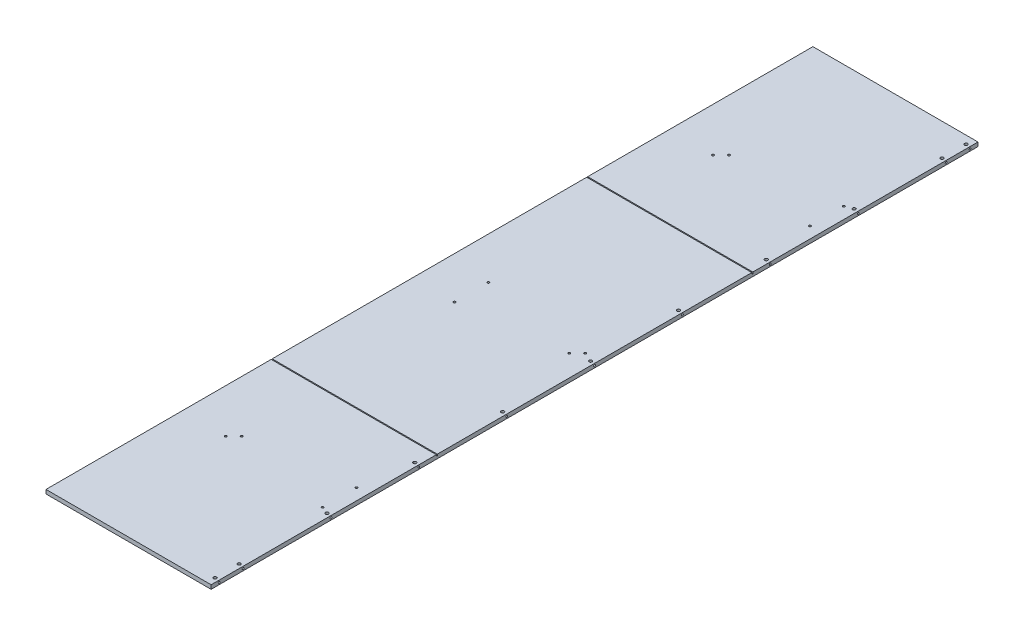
SolidWorks part; units mm, degrees
ref_plane "Front" through (0, 0, 0) normal (0, 0, 1) x (1, 0, 0)
ref_plane "Top" through (0, 0, 0) normal (0, 1, 0) x (1, 0, 0)
ref_plane "Right" through (0, 0, 0) normal (1, 0, 0) x (0, 0, -1)
sketch "Sketch1" plane through (0, 0, 0) normal (0, 1, 0) x (1, 0, 0)
  line L2 (0, 0) -> (0, 1025.398)
  line L4 (524.999, 0) -> (524.999, 1025.398)
  line L6 (0, 1025.398) -> (0, 1731.899)
  line L7 (0, 1731.899) -> (524.999, 1731.899)
  line L8 (524.999, 1025.398) -> (524.999, 1731.899)
  line L10 (0, 0) -> (0, -706.501)
  line L11 (0, -706.501) -> (524.999, -706.501)
  line L12 (524.999, 0) -> (524.999, -706.501)
  dimension "D1" = 1025.398
  dimension "D2" = 524.999
  dimension "D3" = 706.501
  dimension "D4" = 706.501
extrude "Extrude1" add sketch "Sketch1" along normal blind 12.7
sketch "Sketch2" plane through (0, 12.7, 0) normal (0, 1, 0) x (1, 0, 0)
  line L1 (-64.3156, 12.7) -> (592.8604, 12.7)
  line L2 (-64.3156, 12.7) -> (-64.3156, 9.525)
  line L3 (-64.3156, 9.525) -> (592.8604, 9.525)
  line L4 (592.8604, 12.7) -> (592.8604, 9.525)
  line L5 (524.999, 512.699) -> (636.1805, 512.699) construction
  line L6 (524.999, -706.501) -> (524.999, 1731.899) construction
  line L7 (592.8604, 1012.698) -> (592.8604, 1015.873)
  line L8 (-64.3156, 1015.873) -> (592.8604, 1015.873)
  line L9 (-64.3156, 1012.698) -> (-64.3156, 1015.873)
  line L10 (-64.3156, 1012.698) -> (592.8604, 1012.698)
  line L11 (0, -706.501) -> (524.999, -706.501) construction
  dimension "D2" = 3.175
  dimension "D3" = 719.201
extrude "Cut-Extrude1" cut sketch "Sketch2" against normal blind 4.7625
sketch "Sketch3" plane through (0, 0, 0) normal (0, -1, 0) x (1, 0, 0)
  circle A0 centre (488.95, -1233.3706) radius 3.3731
  circle A1 centre (488.95, -1341.3206) radius 3.3731
  circle A2 centre (482.6, -525.399) radius 3.3731
  circle A3 centre (488.95, 316.0294) radius 3.3731
  circle A4 centre (488.95, 208.0794) radius 3.3731
  circle A5 centre (165.1, 249.301) radius 3.3731
  circle A6 centre (165.1, -1300.099) radius 3.3731
  circle A7 centre (139.7, -1274.699) radius 3.3731
  circle A8 centre (457.2, -499.999) radius 3.3731
  circle A9 centre (139.7, 274.701) radius 3.3731
  dimension "D1" = 6.7462
  dimension "D2" = 6.7462
  dimension "D3" = 6.7462
  dimension "D4" = 6.7462
  dimension "D5" = 6.7462
extrude "Cut-Extrude2" cut sketch "Sketch3" against normal through all
sketch "Sketch4" plane through (0, 0, 0) normal (0, -1, 0) x (1, 0, 0)
  circle A0 centre (133.35, -566.6206) radius 3.3731
  circle A1 centre (133.35, -458.7774) radius 3.3731
  dimension "D1" = 6.7462
extrude "Cut-Extrude3" cut sketch "Sketch4" against normal through all
sketch "Sketch5" plane through (0, 12.7, 0) normal (0, 1, 0) x (1, 0, 0)
  line L0 (524.9989, 1015.873) -> (524.999, 1731.899) construction
  line L2 (512.2989, 1630.299) -> (512.2989, -778.6842) construction
  line L4 (0, -706.501) -> (524.999, -706.501) construction
  line L5 (0, 512.699) -> (512.2989, 512.699) construction
  line L6 (0, 1012.698) -> (0, 12.7) construction
  line L7 (524.999, 1731.899) -> (0, 1731.899) construction
  line L8 (524.999, -706.501) -> (524.999, 9.525) construction
  circle A0 centre (512.2989, 1630.299) radius 4.9022
  circle A1 centre (512.2989, 1350.899) radius 4.9022
  circle A2 centre (512.2989, 1071.499) radius 4.9022
  circle A3 centre (512.2989, 792.099) radius 4.9022
  circle A4 centre (512.2989, 512.699) radius 4.9022
  circle A5 centre (512.2989, 233.299) radius 4.9022
  circle A6 centre (512.2989, -46.101) radius 4.9022
  circle A7 centre (512.2989, -325.501) radius 4.9022
  circle A8 centre (512.299, -681.101) radius 4.9022
  circle A9 centre (512.2989, -604.901) radius 4.9022
  circle A10 centre (512.2989, 1706.499) radius 4.9022
  dimension "D1" = 9.8044
  dimension "D2" = 12.7
  dimension "D4" = 279.4
  dimension "D5" = 279.4
  dimension "D6" = 279.4
  dimension "D7" = 279.4
  dimension "D3" = 279.4
  dimension "D8" = 279.4
  dimension "D9" = 279.4
  dimension "D12" = 25.4
  dimension "D10" = 25.4
  dimension "D11" = 279.4
  dimension "D13" = 12.7
  dimension "D14" = 12.7
extrude "Extrude2" cut sketch "Sketch5" against normal through all
sketch "Sketch6" plane through (524.999, 0, 0) normal (1, 0, 0) x (0, 0, -1)
  line L0 (-706.501, 6.35) -> (1731.899, 6.35) construction
  line L1 (-706.501, 12.7) -> (-706.501, 0) construction
  line L2 (1731.899, 12.7) -> (1731.899, 0) construction
  line L3 (-681.101, 0) -> (-681.101, 12.7) construction
  circle A0 centre (-681.101, 6.35) radius 2.8067
  circle A1 centre (-604.901, 6.35) radius 2.8067
  circle A2 centre (-325.501, 6.35) radius 2.8067
  circle A3 centre (-46.101, 6.35) radius 2.8067
  circle A4 centre (233.299, 6.35) radius 2.8067
  circle A5 centre (512.699, 6.35) radius 2.8067
  circle A6 centre (792.099, 6.35) radius 2.8067
  circle A7 centre (1071.499, 6.35) radius 2.8067
  circle A8 centre (1350.899, 6.35) radius 2.8067
  circle A9 centre (1630.299, 6.35) radius 2.8067
  circle A10 centre (1706.499, 6.35) radius 2.8067
  dimension "D1" = 5.6134
  dimension "D5" = 279.4
  dimension "D6" = 279.4
  dimension "D7" = 279.4
  dimension "D8" = 279.4
  dimension "D9" = 279.4
  dimension "D10" = 279.4
  dimension "D12" = 76.2
  dimension "D2" = 25.4
  dimension "D3" = 101.6
  dimension "D4" = 381
  dimension "D11" = 279.4
extrude "Extrude3" cut sketch "Sketch6" against normal blind 12.7
